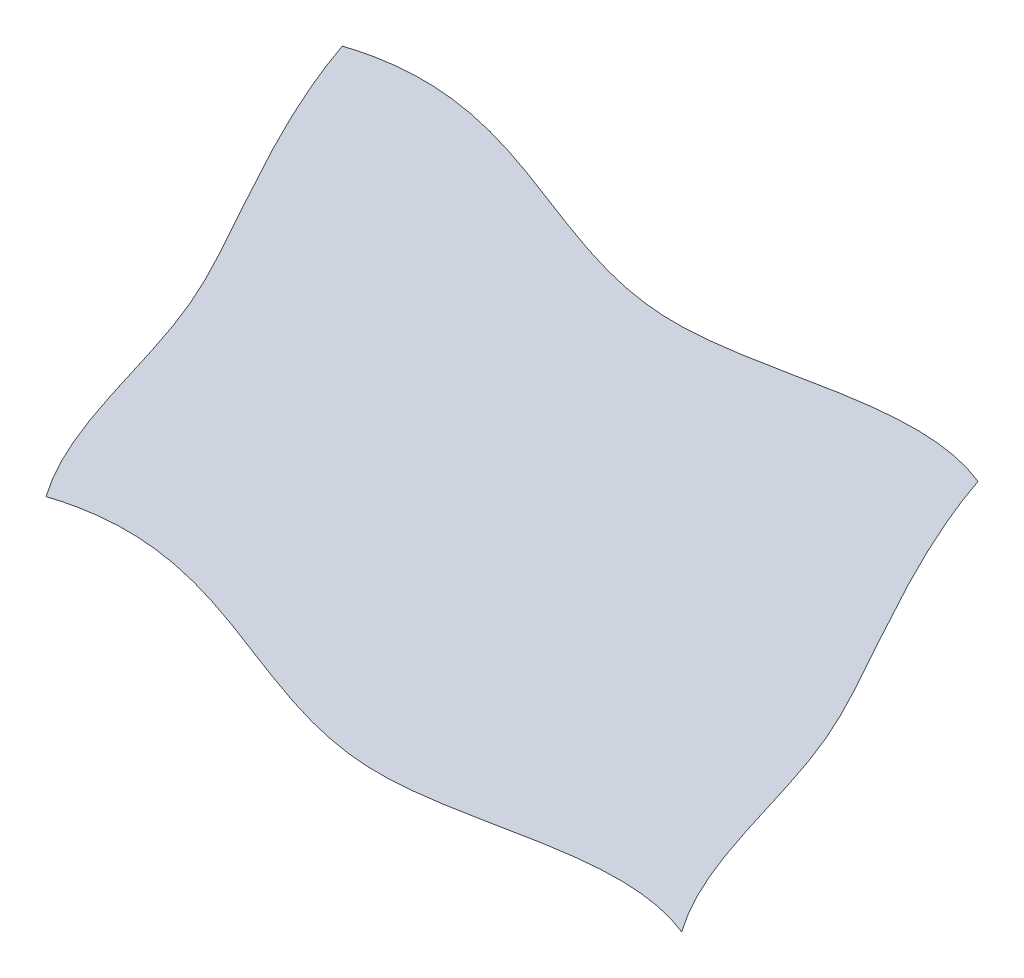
SolidWorks part; units mm, degrees
ref_plane "Front Plane" through (0, 0, 0) normal (0, 0, 1) x (1, 0, 0)
ref_plane "Top Plane" through (0, 0, 0) normal (0, 1, 0) x (1, 0, 0)
ref_plane "Right Plane" through (0, 0, 0) normal (1, 0, 0) x (0, 0, -1)
sketch "Sketch1" plane through (0, 0, 0) normal (0, 1, 0) x (1, 0, 0)
  spline S0 degree 3 poles (-66.8128, 3.8376) (-44.4007, 8.2889) (-4.0558, -8.2342) (36.2598, 7.9217) (54.287, 0) knots 0 0 0 0 0.550374 1 1 1 1
  spline S1 degree 3 poles (-100.7361, 84.3387) (-76.5118, 92.3274) (-39.5825, 57.9825) (1.5594, 81.0171) (18.3738, 74.202) knots 0 0 0 0 0.576263 1 1 1 1
  spline S2 degree 3 poles (-66.8128, 3.8376) (-77.2937, 13.6248) (-84.2043, 29.2508) (-88.9364, 53.2424) (-103.0126, 74.3419) (-99.8402, 98.2285) (-113.3346, 108.2398) knots 0 0 0 0 0.361721 0.433484 0.634003 1 1 1 1
  spline S3 degree 3 poles (54.287, 0) (51.3037, 14.8894) (37.3838, 31.1446) (27.6472, 68.1535) (7.8616, 83.8333) (2.0401, 99.9802) knots 0 0 0 0 0.391601 0.545827 1 1 1 1
  spline S4 degree 3 poles (-88.2513, 48.2796) (-65.1291, 37.5873) (-23.0228, 41.3792) (18.465, 39.9693) (35.7596, 40.2445) knots 0 0 0 0 0.585603 1 1 1 1
  spline S5 degree 3 poles (0, 0) (-8.5776, 12.1235) (-11.324, 33.1809) (-27.7693, 62.8632) (-37.1803, 79.6755) (-41.4855, 92.2905) knots 0 0 0 0 0.427909 0.608963 1 1 1 1
other "Boundary-Surface2"
